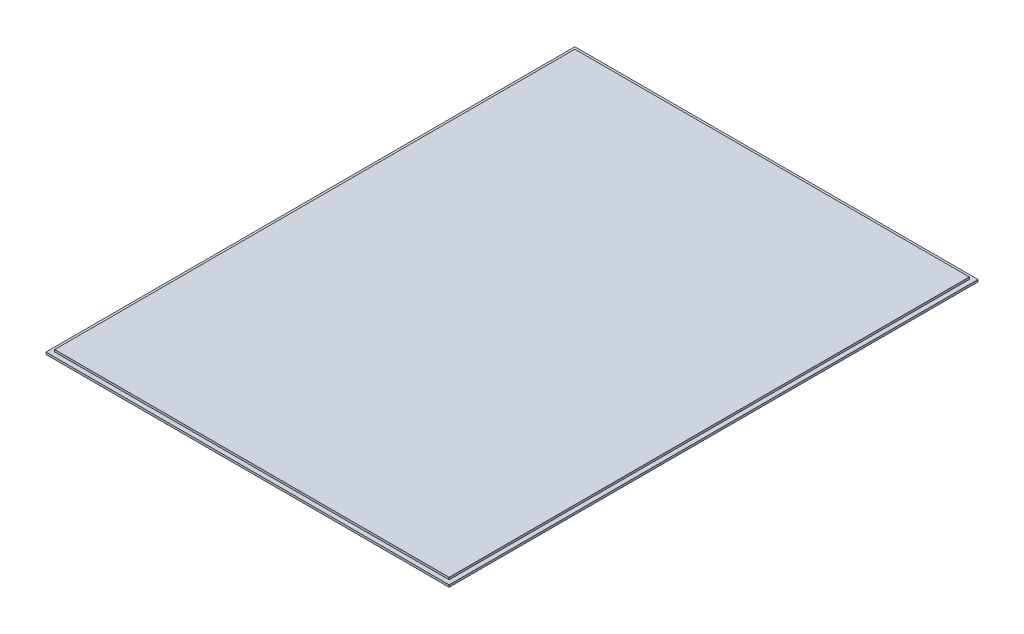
SolidWorks part; units mm, degrees
ref_plane "Front Plane" through (0, 0, 0) normal (0, 0, 1) x (1, 0, 0)
ref_plane "Top Plane" through (0, 0, 0) normal (0, 1, 0) x (1, 0, 0)
ref_plane "Right Plane" through (0, 0, 0) normal (1, 0, 0) x (0, 0, -1)
sketch "Sketch1" plane through (0, 0, 0) normal (0, 1, 0) x (1, 0, 0)
  line L1 (-295.275, -387.35) -> (295.275, -387.35)
  line L2 (-295.275, -387.35) -> (-295.275, 387.35)
  line L3 (-295.275, 387.35) -> (295.275, 387.35)
  line L4 (295.275, -387.35) -> (295.275, 387.35)
  line L5 (-295.275, -387.35) -> (295.275, 387.35) construction
  line L6 (-295.275, 387.35) -> (295.275, -387.35) construction
  point P0 (0, 0)
  dimension "D1" = 590.55
  dimension "D2" = 774.7
extrude "Boss-Extrude1" add sketch "Sketch1" along normal blind 6.35
sketch "Sketch3" plane through (0, 6.35, 0) normal (0, 1, 0) x (1, 0, 0)
  line L0 (295.275, 387.35) -> (-295.275, 387.35) construction
  line L1 (-288.925, -381) -> (288.925, -381)
  line L2 (-288.925, -381) -> (-288.925, 381)
  line L3 (-288.925, 381) -> (288.925, 381)
  line L4 (288.925, -381) -> (288.925, 381)
  line L5 (-288.925, -381) -> (288.925, 381) construction
  line L6 (-288.925, 381) -> (288.925, -381) construction
  line L7 (-295.275, 387.35) -> (-295.275, -387.35) construction
  point P0 (0, 0)
  dimension "D1" = 6.35
  dimension "D2" = 6.35
extrude "Cut-Extrude1" cut sketch "Sketch3" against normal blind 3.175 flip side to cut
